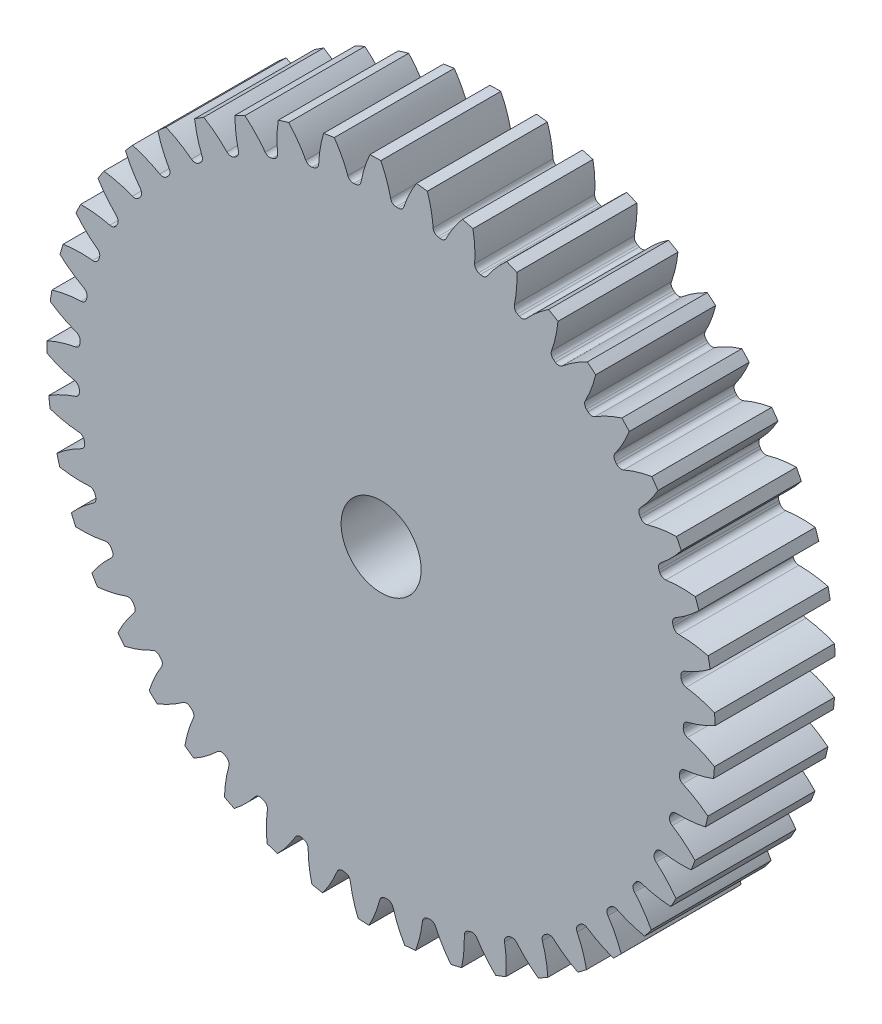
SolidWorks part; units mm, degrees
ref_plane "Front" through (0, 0, 0) normal (0, 0, 1) x (1, 0, 0)
ref_plane "Top" through (0, 0, 0) normal (0, 1, 0) x (1, 0, 0)
ref_plane "Right" through (0, 0, 0) normal (1, 0, 0) x (0, 0, -1)
sketch "Sketch3" plane through (0, 0, 0) normal (0, 0, 1) x (1, 0, 0)
  circle A0 centre (0, 0) radius 265.2889
  dimension "od" = 530.5778
extrude "gearBody" add sketch "Sketch3" along normal blind 95.25
sketch "Sketch2" plane through (0, 0, 0) normal (0, 0, 1) x (1, 0, 0)
  line L0 (0, 0) -> (220.5133, 91.3396) construction
  line L1 (264.7835, -18.9696) -> (0, 0) construction
  line L2 (0, 0) -> (36.3143, 0) construction
  line L3 (253.963, 4.3377) -> (253.6504, -13.322) construction
  line L5 (253.8067, -4.4921) -> (0, 0) construction
  line L7 (0, 0) -> (238.6819, 0) construction
  arc A0 (238.6819, -0.0831) -> (238.5354, -8.3632) centre (0, 0) ccw construction
  arc A1 (265.1189, 9.495) -> (264.6169, -18.8708) centre (0, 0) ccw construction
  arc A2 (253.963, 4.3377) -> (253.6504, -13.322) centre (0, 0) ccw construction
  arc A3 (239.8354, -5.0668) -> (239.8645, -3.4234) centre (0, 0) ccw
  arc A4 (264.7835, -18.9696) -> (243.1471, -9.576) centre (217.143, -99.0857) ccw
  arc A5 (264.7835, -18.9696) -> (265.2889, 9.5878) centre (0, 0) ccw
  arc A6 (265.2889, 9.5878) -> (243.3337, 0.9657) centre (220.5133, 91.3396) cw
  arc A7 (239.8645, -3.4234) -> (243.3337, 0.9657) centre (244.4586, -3.489) cw
  arc A8 (243.1471, -9.576) -> (239.8354, -5.0668) centre (244.4289, -5.1638) cw
  point P6 (265.2889, 9.5878)
  point P22 (264.7835, -18.9696)
  dimension "baseDia" = 477.3639
  dimension "od" = 530.5778
  dimension "pd" = 508
  dimension "rd" = 479.7778
  dimension "rFillet" = 4.5946
  dimension "pointX" = 265.2889
  dimension "pointY" = 9.5878
  dimension "CTT" = 17.6597
  dimension "flankCenterAngle" = 22.5
extrude "toothCut" cut sketch "Sketch2" along normal through all
pattern_circular "CirPattern1" count 45 over 360 about axis through (0, 0, 0) along (0, 0, 1) of "toothCut"
sketch "hub1Dia" plane through (0, 0, 0) normal (0, 0, -1) x (-1, 0, 0)
  circle A0 centre (0, 0) radius 12.7
  dimension "hub1Dia" = 25.4
sketch "hub2Dia" plane through (0, 0, 95.25) normal (0, 0, 1) x (1, 0, 0)
  circle A0 centre (0, 0) radius 12.7
  dimension "hub2dia" = 25.4
sketch "boreDia" plane through (0, 0, 0) normal (0, 0, 1) x (1, 0, 0)
  circle A0 centre (0, 0) radius 31.75
  dimension "boreDia" = 63.5
extrude "bore" cut sketch "boreDia" against normal mid plane 25400
